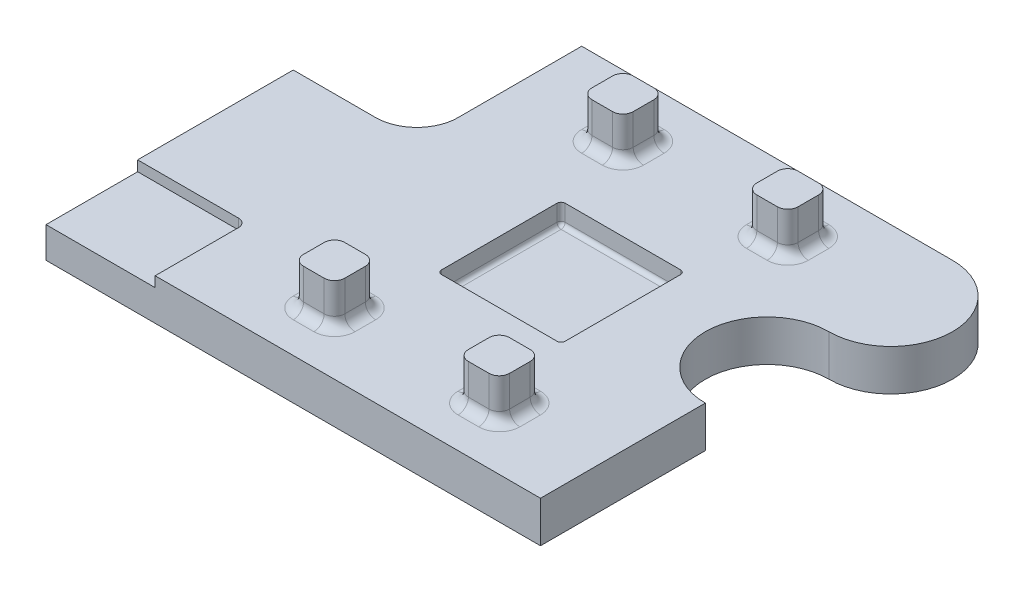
SolidWorks part; units mm, degrees
ref_plane "Front Plane" through (0, 0, 0) normal (0, 0, 1) x (1, 0, 0)
ref_plane "Top Plane" through (0, 0, 0) normal (0, 1, 0) x (1, 0, 0)
ref_plane "Right Plane" through (0, 0, 0) normal (1, 0, 0) x (0, 0, -1)
sketch "Sketch1" plane through (0, 0, 0) normal (0, 1, 0) x (1, 0, 0)
  line L0 (-76.2, 63.5) -> (-76.2, -63.5)
  line L1 (-76.2, 63.5) -> (76.2, 63.5)
  line L2 (-76.2, -63.5) -> (76.2, 63.5) construction
  line L3 (-76.2, -63.5) -> (76.2, -63.5)
  line L4 (76.2, -12.7) -> (76.2, -63.5)
  arc A0 (76.2, 63.5) -> (76.2, 25.4) centre (76.2, 44.45) cw
  arc A1 (76.2, 25.4) -> (76.2, -12.7) centre (76.2, 6.35) ccw
  dimension "D3" = 19.05
  dimension "D4" = 19.05
  dimension "D6" = 152.4
  dimension "D1" = 127
  dimension "D2" = 152.4
  dimension "D5" = 50.8
extrude "Extrude1" add sketch "Sketch1" along normal blind 12.7
sketch "Sketch2" plane through (0, 12.7, 0) normal (0, 1, 0) x (-1, 0, 0)
  line L0 (0, 0) -> (-115.8202, 0) construction
  line L1 (-38.1, -50.8) -> (-50.8, -50.8)
  line L2 (-38.1, -50.8) -> (-38.1, -38.1)
  line L3 (-38.1, -38.1) -> (-50.8, -38.1)
  line L4 (-50.8, -50.8) -> (-50.8, -38.1)
  line L5 (-38.1, 38.1) -> (-50.8, 38.1)
  line L6 (-38.1, 38.1) -> (-38.1, 50.8)
  line L7 (-38.1, 50.8) -> (-50.8, 50.8)
  line L8 (-50.8, 38.1) -> (-50.8, 50.8)
  line L10 (0, 50.8) -> (12.7, 50.8)
  line L11 (0, 50.8) -> (0, 38.1)
  line L12 (0, 38.1) -> (12.7, 38.1)
  line L13 (12.7, 50.8) -> (12.7, 38.1)
  line L14 (0, -38.1) -> (12.7, -38.1)
  line L15 (0, -38.1) -> (0, -50.8)
  line L16 (0, -50.8) -> (12.7, -50.8)
  line L17 (12.7, -38.1) -> (12.7, -50.8)
  dimension "D1" = 12.7
  dimension "D2" = 12.7
  dimension "D3" = 12.7
  dimension "D4" = 12.7
  dimension "D5" = 38.1
  dimension "D6" = 38.1
  dimension "D7" = 12.7
  dimension "D8" = 38.1
extrude "Extrude2" add sketch "Sketch2" along normal blind 12.7
fillet "Fillet2" radius 3.175 32 edges at (38.1, 12.7, -44.45) (38.1, 19.05, -50.8) (44.45, 12.7, -38.1) (38.1, 19.05, -38.1) (50.8, 12.7, -44.45) (50.8, 19.05, -38.1) (44.45, 12.7, -50.8) (50.8, 19.05, -50.8) (38.1, 12.7, 44.45) (38.1, 19.05, 38.1) (44.45, 12.7, 50.8) (38.1, 19.05, 50.8) (50.8, 12.7, 44.45) (50.8, 19.05, 50.8) (44.45, 12.7, 38.1) (50.8, 19.05, 38.1) (0, 12.7, 44.45) (0, 19.05, 50.8) (-6.35, 12.7, 38.1) (0, 19.05, 38.1) (-12.7, 12.7, 44.45) (-12.7, 19.05, 38.1) (-6.35, 12.7, 50.8) (-12.7, 19.05, 50.8) (0, 12.7, -44.45) (0, 19.05, -38.1) (-6.35, 12.7, -50.8) (0, 19.05, -50.8) (-12.7, 12.7, -44.45) (-12.7, 19.05, -50.8) (-6.35, 12.7, -38.1) (-12.7, 19.05, -38.1)
sketch "Sketch3" plane through (0, 12.7, 0) normal (0, 1, 0) x (-1, 0, 0)
  line L0 (0, 0) -> (-38.1, 0) construction
  line L1 (0, -19.05) -> (-38.1, -19.05)
  line L2 (0, -19.05) -> (0, 19.05)
  line L3 (0, 19.05) -> (-38.1, 19.05)
  line L4 (-38.1, -19.05) -> (-38.1, 19.05)
  dimension "D1" = 38.1
  dimension "D2" = 38.1
  dimension "D3" = 38.1
extrude "Cut-Extrude1" cut sketch "Sketch3" against normal blind 6.35
fillet "Fillet3" radius 1.27 8 edges at (0, 6.35, 0) (0, 9.525, 19.05) (19.05, 6.35, -19.05) (0, 9.525, -19.05) (38.1, 6.35, 0) (38.1, 9.525, -19.05) (19.05, 6.35, 19.05) (38.1, 9.525, 19.05)
sketch "Sketch5" plane through (0, 12.7, 0) normal (0, 1, 0) x (-1, 0, 0)
  line L0 (38.1, -63.5) -> (38.1, -25.4)
  line L1 (-76.2, -63.5) -> (76.2, -63.5) construction
  line L2 (50.8, -12.7) -> (76.2, -12.7)
  line L3 (76.2, -63.5) -> (76.2, 63.5) construction
  arc A0 (38.1, -25.4) -> (50.8, -12.7) centre (50.8, -25.4) cw
  dimension "D3" = 12.7
  dimension "D1" = 38.1
  dimension "D2" = 50.8
extrude "Cut-Extrude3" cut sketch "Sketch5" against normal through all and the other way through all flip side to cut
sketch "Sketch6" plane through (0, 12.7, 0) normal (0, 1, 0) x (-1, 0, 0)
  line L1 (60.5137, 25.4) -> (70.8395, 25.4) construction
  line L2 (76.2, 35.261) -> (45.1027, 35.261)
  line L4 (76.2, -12.7) -> (76.2, 63.5) construction
  line L5 (76.2, 63.5) -> (-76.2, 63.5) construction
  line L6 (50.8, -12.7) -> (76.2, -12.7) construction
  line L7 (42.5627, 37.801) -> (42.5627, 63.5)
  line L8 (42.5627, 63.5) -> (76.2, 63.5)
  line L9 (76.2, 63.5) -> (76.2, 35.261)
  arc A0 (45.1027, 35.261) -> (42.5627, 37.801) centre (45.1027, 37.801) cw
  dimension "D1" = 2.54
extrude "Cut-Extrude4" cut sketch "Sketch6" against normal blind 3.175
